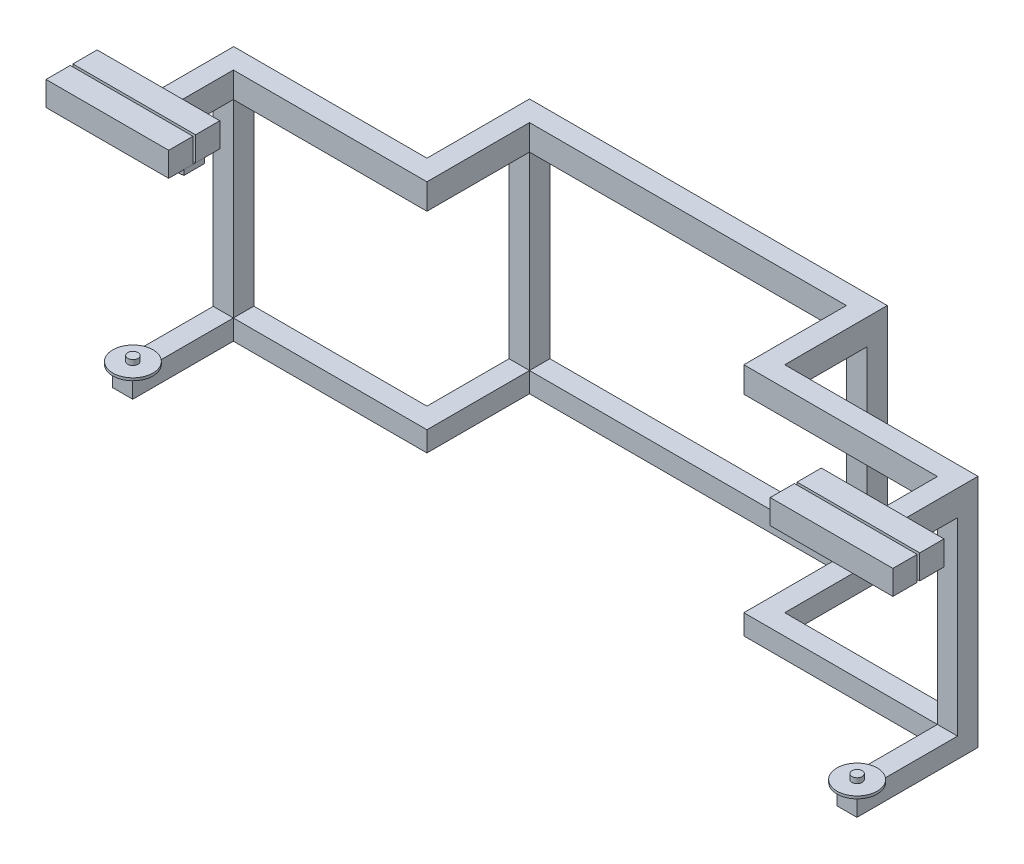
SolidWorks part; units mm, degrees
ref_plane "Front Plane" through (0, 0, 0) normal (0, 0, 1) x (1, 0, 0)
ref_plane "Top Plane" through (0, 0, 0) normal (0, 1, 0) x (1, 0, 0)
ref_plane "Right Plane" through (0, 0, 0) normal (1, 0, 0) x (0, 0, -1)
sketch "Sketch1" plane through (0, 0, 0) normal (0, 0, 1) x (1, 0, 0)
  line L1 (0, 0) -> (1849.15, 0) construction
  line L2 (0, 0) -> (0, 470) construction
  line L3 (0, 470) -> (1849.15, 470) construction
  line L4 (1849.15, 0) -> (1849.15, 470) construction
  point P5 (0, 0)
  dimension "D1" = 1849.15
  dimension "D2" = 470
sketch "Sketch2" plane through (0, 0, 0) normal (0, 1, 0) x (1, 0, 0)
  line L0 (0, 0) -> (1849.15, 0) construction
  line L1 (0, 0) -> (1849.15, 0) construction
  line L2 (0, 0) -> (0, 300.7458) construction
  line L3 (0, 300.7458) -> (1849.15, 300.7458) construction
  line L4 (1849.15, 0) -> (1849.15, 300.7458) construction
  line L5 (0, 50.8) -> (1849.15, 50.8) construction
  line L6 (50, 50.8) -> (50, 0) construction
  line L7 (1799.15, 0) -> (1799.15, 50.8) construction
  line L8 (50, 50.8) -> (0, 0) construction
  line L9 (25, 25.4) -> (25, 0) construction
  line L10 (1799.15, 50.8) -> (1849.15, 0) construction
  line L11 (1824.15, 25.4) -> (1824.15, 0) construction
  line L12 (25, 25.4) -> (25, 50.8) construction
  line L13 (1824.15, 25.4) -> (1824.15, 50.8) construction
  line L14 (924.575, 300.7458) -> (924.575, 0) construction
  dimension "D1" = 1849.15
  dimension "D2" = 300.7458
  dimension "D3" = 50.8
  dimension "D4" = 50
  dimension "D5" = 50
sketch "Sketch3" plane through (0, 0, 0) normal (0, 1, 0) x (1, 0, 0)
  line L0 (924.575, 300.7458) -> (924.575, 0) construction
  circle A0 centre (25, 25.4) radius 50
  dimension "D1" = 100
extrude "Boss-Extrude6" add sketch "Sketch3" along normal blind 6.35 contours A0
sketch "Sketch9" plane through (0, 0, 0) normal (0, 0, 1) x (1, 0, 0)
  line L1 (0, 0) -> (50, 0)
  line L2 (0, 0) -> (0, -50)
  line L3 (0, -50) -> (50, -50)
  line L4 (50, 0) -> (50, -50)
extrude "Boss-Extrude7" add sketch "Sketch9" against normal up to vertex (300.7458 mm away)
sketch "Sketch10" plane through (0, 0, 0) normal (0, 1, 0) x (1, 0, 0)
  line L0 (50, 50.8) -> (50, 0) construction
  line L1 (0, 300.7458) -> (480.153, 300.7458)
  line L2 (0, 300.7458) -> (0, 249.9458)
  line L3 (0, 249.9458) -> (480.153, 249.9458)
  line L5 (924.575, 300.7458) -> (924.575, 504.7332) construction
  line L6 (480.153, 249.9458) -> (530.953, 249.9458)
  line L7 (480.153, 300.7458) -> (480.153, 555.5332)
  line L8 (480.153, 555.5332) -> (530.953, 555.5332)
  line L9 (530.953, 249.9458) -> (530.953, 504.7332)
  line L10 (530.953, 555.5332) -> (924.575, 555.5332)
  line L12 (530.953, 504.7332) -> (924.575, 504.7332)
  line L13 (924.575, 555.5332) -> (924.575, 504.7332)
  line L14 (0, 300.7458) -> (1849.15, 300.7458) construction
  dimension "D1" = 480.153
  dimension "D2" = 254.7874
  dimension "D3" = 530.953
extrude "Boss-Extrude8" add sketch "Sketch10" against normal up to surface (50 mm away) contours L7 L8 L10 L13 L12 L9 L6 L3 L2 L1
ref_plane "Plane3" through (924.575, 0, 0) normal (1, 0, 0) x (0, 0, -1)
mirror "Mirror1" about plane through (924.575, 0, 0) normal (1, 0, 0) of "Boss-Extrude7", "Boss-Extrude6", "Boss-Extrude8"
mirror "Mirror2" about plane through (924.575, 0, 0) normal (1, 0, 0) of "Boss-Extrude7"
mirror "Mirror3" about plane through (924.575, 0, 0) normal (1, 0, 0) of "Boss-Extrude6"
sketch "Sketch11" plane through (0, 0, 0) normal (0, 1, 0) x (1, 0, 0)
  line L1 (0, 300.7458) -> (50, 300.7458)
  line L2 (0, 300.7458) -> (0, 249.9458)
  line L3 (0, 249.9458) -> (50, 249.9458)
  line L4 (50, 300.7458) -> (50, 249.9458)
  line L5 (480.153, 555.5332) -> (530.953, 555.5332)
  line L6 (480.153, 555.5332) -> (480.153, 504.7332)
  line L7 (480.153, 504.7332) -> (530.953, 504.7332)
  line L8 (530.953, 555.5332) -> (530.953, 504.7332)
  line L9 (1368.997, 555.5332) -> (1318.197, 555.5332)
  line L10 (1368.997, 555.5332) -> (1368.997, 504.7332)
  line L11 (1368.997, 504.7332) -> (1318.197, 504.7332)
  line L12 (1318.197, 555.5332) -> (1318.197, 504.7332)
  line L13 (1849.15, 300.7458) -> (1799.15, 300.7458)
  line L14 (1849.15, 300.7458) -> (1849.15, 249.9458)
  line L15 (1849.15, 249.9458) -> (1799.15, 249.9458)
  line L16 (1799.15, 300.7458) -> (1799.15, 249.9458)
extrude "Boss-Extrude9" add sketch "Sketch11" along normal up to vertex (470 mm away)
ref_plane "Plane4" through (0, 470, 0) normal (0, 1, 0) x (1, 0, 0)
sketch "Sketch12" plane through (0, 470, 0) normal (0, 1, 0) x (1, 0, 0)
  line L26 (0, 300.7458) -> (0, 0)
  line L39 (0, 0) -> (1849.15, 0)
  line L40 (1849.15, 0) -> (1849.15, 300.7458)
  line L41 (1849.15, 300.7458) -> (1368.997, 300.7458)
  line L42 (1368.997, 300.7458) -> (1368.997, 555.5332)
  line L43 (1368.997, 555.5332) -> (480.153, 555.5332)
  line L44 (480.153, 555.5332) -> (480.153, 300.7458)
  line L45 (480.153, 300.7458) -> (0, 300.7458)
  line L46 (1799.15, 249.9458) -> (1799.15, 50.8)
  line L47 (1799.15, 50.8) -> (50, 50.8)
  line L48 (50, 50.8) -> (50, 249.9458)
  line L49 (50, 249.9458) -> (530.953, 249.9458)
  line L50 (530.953, 249.9458) -> (530.953, 504.7332)
  line L51 (530.953, 504.7332) -> (1318.197, 504.7332)
  line L52 (1318.197, 504.7332) -> (1318.197, 249.9458)
  line L53 (1318.197, 249.9458) -> (1799.15, 249.9458)
extrude "Boss-Extrude10" add sketch "Sketch12" along normal blind 63.5
sketch "Sketch13" plane through (0, 470, 0) normal (0, 1, 0) x (1, 0, 0)
  line L0 (0, 50.8) -> (1849.15, 50.8) construction
  line L1 (1849.15, 0) -> (1671.75, 0)
  line L2 (1849.15, 0) -> (1849.15, 50.8)
  line L3 (1799.15, 50.8) -> (1671.75, 50.8)
  line L4 (1671.75, 0) -> (1671.75, 50.8)
  line L5 (1849.15, 0) -> (1849.15, 300.7458) construction
  line L6 (1849.15, 88.9) -> (1799.15, 88.9)
  line L7 (1849.15, 88.9) -> (1849.15, 50.8)
  line L9 (1799.15, 88.9) -> (1799.15, 50.8)
  line L10 (924.575, 555.5332) -> (924.575, 0) construction
  line L11 (1368.997, 555.5332) -> (480.153, 555.5332) construction
  line L12 (0, 0) -> (1849.15, 0) construction
  line L13 (50, 88.9) -> (50, 50.8)
  line L14 (0, 88.9) -> (0, 50.8)
  line L15 (0, 88.9) -> (50, 88.9)
  line L16 (177.4, 0) -> (177.4, 50.8)
  line L17 (50, 50.8) -> (177.4, 50.8)
  line L18 (0, 0) -> (0, 50.8)
  line L19 (0, 0) -> (177.4, 0)
  dimension "D1" = 152.4
  dimension "D2" = 63.5
extrude "Cut-Extrude1" cut sketch "Sketch13" along normal up to surface (63.5 mm away) contours L16 L17 L13 L15 L14 L18 L19
ref_plane "Plane5" through (0, 501.75, 0) normal (0, 1, 0) x (1, 0, 0)
sketch "Sketch14" plane through (0, 501.75, 0) normal (0, 1, 0) x (1, 0, 0)
  line L0 (0, 88.9) -> (-20.0838, 47.0205)
  line L1 (50, 88.9) -> (58.8386, 70.4695)
  line L2 (58.8386, 70.4695) -> (177.4, 50.8)
  line L3 (0, 50.8) -> (1849.15, 50.8) construction
  line L4 (33.1832, -23.9258) -> (177.4, 0)
  line L5 (177.4, 0) -> (177.4, 50.8)
  line L6 (924.575, 0) -> (924.575, 300.7458) construction
  line L12 (0, 88.9) -> (50, 88.9)
  line L14 (1849.15, 88.9) -> (1799.15, 88.9)
  line L15 (1671.75, 0) -> (1671.75, 50.8)
  line L16 (1815.9668, -23.9258) -> (1671.75, 0)
  line L17 (1790.3114, 70.4695) -> (1671.75, 50.8)
  line L18 (1799.15, 88.9) -> (1790.3114, 70.4695)
  line L19 (1849.15, 88.9) -> (1869.2338, 47.0205)
  arc A0 (-20.0838, 47.0205) -> (33.1832, -23.9258) centre (25, 25.4) ccw
  circle A2 centre (25, 25.4) radius 50 construction
  arc A6 (1869.2338, 47.0205) -> (1815.9668, -23.9258) centre (1824.15, 25.4) cw
  point P4 (0, 0)
extrude "Boss-Extrude11" add sketch "Sketch14" against normal mid plane 12.7 contours L2 L5 L4 A0 L0 L12 L1
sketch "Sketch15" plane through (0, 508.1, 0) normal (0, 1, 0) x (1, 0, 0)
  line L0 (1799.15, 50.8) -> (1849.15, 0) construction
  circle A0 centre (25, 25.4) radius 12.7
  circle A1 centre (1824.15, 25.4) radius 12.7
  dimension "D1" = 25.4
  dimension "D2" = 25.4
extrude "Cut-Extrude2" cut sketch "Sketch15" against normal up to surface (12.7 mm away)
sketch "Sketch16" plane through (0, 508.1, 0) normal (0, 1, 0) x (1, 0, 0)
  line L0 (177.4, 0) -> (177.4, 50.8) construction
  line L1 (-127.4, 88.9) -> (177.4, 88.9)
  line L2 (-127.4, 88.9) -> (-127.4, 28.575)
  line L3 (-127.4, -38.1) -> (177.4, -38.1)
  line L4 (177.4, 88.9) -> (177.4, 28.575)
  line L5 (50, 88.9) -> (0, 88.9) construction
  line L6 (-127.4, 25.4) -> (177.4, 25.4) construction
  line L7 (-127.4, 22.225) -> (177.4, 22.225)
  line L8 (-127.4, 28.575) -> (177.4, 28.575)
  line L9 (177.4, 22.225) -> (177.4, -38.1)
  line L10 (-127.4, 22.225) -> (-127.4, -38.1)
  line L11 (-127.4, 28.575) -> (-127.4, 25.4) construction
  line L12 (-127.4, 25.4) -> (-127.4, 22.225) construction
  line L13 (924.575, 0) -> (924.575, 504.7332) construction
  line L14 (177.4, 0) -> (1671.75, 0) construction
  line L15 (1318.197, 504.7332) -> (530.953, 504.7332) construction
  line L16 (1976.55, 25.4) -> (1976.55, 22.225) construction
  line L17 (1976.55, 28.575) -> (1976.55, 25.4) construction
  line L18 (1976.55, 25.4) -> (1671.75, 25.4) construction
  line L19 (1976.55, 22.225) -> (1976.55, -38.1)
  line L20 (1671.75, 22.225) -> (1671.75, -38.1)
  line L21 (1976.55, 28.575) -> (1671.75, 28.575)
  line L22 (1976.55, 22.225) -> (1671.75, 22.225)
  line L23 (1671.75, 88.9) -> (1671.75, 28.575)
  line L24 (1976.55, -38.1) -> (1671.75, -38.1)
  line L25 (1976.55, 88.9) -> (1976.55, 28.575)
  line L26 (1976.55, 88.9) -> (1671.75, 88.9)
  dimension "D1" = 304.8
  dimension "D2" = 127
  dimension "D5" = 60.325
  dimension "D3" = 3.175
  dimension "D4" = 3.175
extrude "Boss-Extrude12" add sketch "Sketch16" along normal blind 60.452 separate body contours L10 L3 L9 L7
sketch "Sketch17" plane through (0, 6.35, 0) normal (0, 1, 0) x (1, 0, 0)
  circle A0 centre (25, 25.4) radius 12.7
  circle A1 centre (25, 25.4) radius 50 construction
  circle A2 centre (1824.15, 25.4) radius 12.7
  dimension "D1" = 25.4
extrude "Boss-Extrude13" add sketch "Sketch17" along normal blind 12.7
sketch "Sketch18" plane through (0, 533.5, 0) normal (0, 1, 0) x (1, 0, 0)
  line L1 (177.4, 50.8) -> (1671.75, 50.8)
  line L2 (177.4, 50.8) -> (177.4, 0)
  line L3 (177.4, 0) -> (1671.75, 0)
  line L4 (1671.75, 50.8) -> (1671.75, 0)
  point P6 (177.4, 50.8)
  point P8 (1671.75, 0)
extrude "Cut-Extrude3" cut sketch "Sketch18" against normal up to surface (63.5 mm away)
